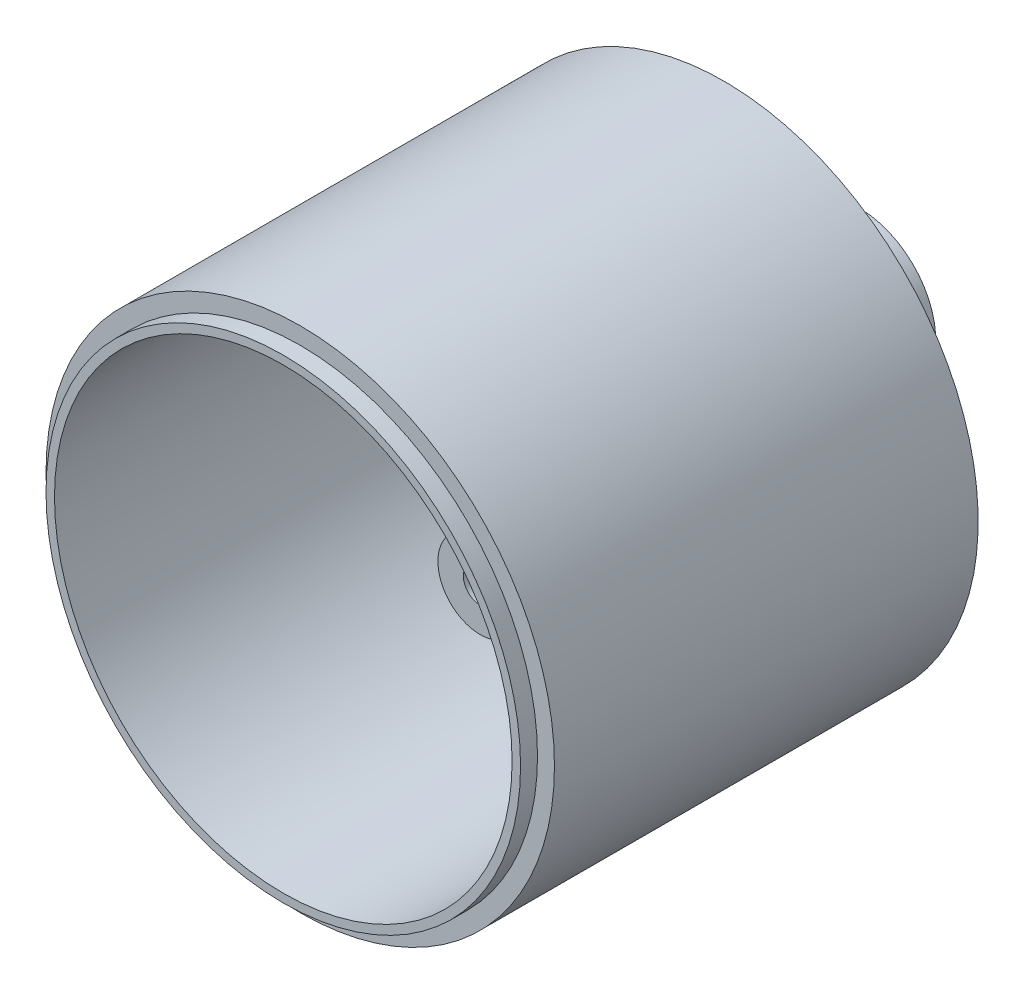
SolidWorks part; units mm, degrees
ref_plane "Face" through (0, 0, 0) normal (0, 0, 1) x (1, 0, 0)
ref_plane "Dessus" through (0, 0, 0) normal (0, 1, 0) x (1, 0, 0)
ref_plane "Droite" through (0, 0, 0) normal (1, 0, 0) x (0, 0, -1)
sketch "Esquisse1" plane through (0, 0, 0) normal (0, 0, 1) x (1, 0, 0)
  circle A0 centre (0, 0) radius 15
  dimension "D1" = 30
extrude "Centrage corps" add sketch "Esquisse1" along normal mid plane 5.5
sketch "Esquisse2" plane through (0, 0, -2.75) normal (0, 0, -1) x (-1, 0, 0)
  line L0 (0, 0) -> (0, -15) construction
  circle A2 centre (0, 0) radius 15
  circle A3 centre (0, 0) radius 15
  dimension "D2" = 0
extrude "Logement pignonerie" add sketch "Esquisse2" along normal blind 19.5
sketch "Esquisse3" plane through (0, 0, -22.25) normal (0, 0, -1) x (-1, 0, 0)
  circle A0 centre (0, 0) radius 5
  dimension "D1" = 10
extrude "Bossage" add sketch "Esquisse3" along normal blind 2
sketch "Esquisse4" plane through (0, 0, -24.25) normal (0, 0, -1) x (-1, 0, 0)
  circle A0 centre (0, 0) radius 4.5
  dimension "D1" = 9
extrude "Guidage de sortie" add sketch "Esquisse4" along normal blind 6
shell "Coque " thickness 1.5
sketch "Esquisse6" plane through (0, 0, -30.25) normal (0, 0, -1) x (-1, 0, 0)
  circle A0 centre (0, 0) radius 2
  dimension "D1" = 4
extrude "Sortie" cut sketch "Esquisse6" against normal through all
sketch "Esquisse8" plane through (0, 0, -20.75) normal (0, 0, 1) x (1, 0, 0)
  circle A0 centre (-3.375, -6.9765) radius 2.5
  dimension "D3" = 5
  dimension "D1" = 7.75
  dimension "D2" = 3.375
extrude "Bossage axe 1" add sketch "Esquisse8" along normal blind 9.5 thin
sketch "Esquisse11" plane through (0, 0, -20.75) normal (0, 0, 1) x (1, 0, 0)
  circle A0 centre (3.3692, -7.2559) radius 2.5
  dimension "D3" = 5
  dimension "D1" = 8
  dimension "D2" = 6.75
extrude "Bossage axe 2" add sketch "Esquisse11" along normal blind 3 thin
sketch "Esquisse9" plane through (0, 0, 2.75) normal (0, 0, 1) x (1, 0, 0)
  circle A0 centre (0, 0) radius 13.5 construction
  circle A1 centre (0, 0) radius 13.5
extrude "Liseré" add sketch "Esquisse9" along normal blind 1 thin
sketch "Esquisse12" plane through (0, 0, -20.75) normal (0, 0, 1) x (1, 0, 0)
  circle A0 centre (0, 0) radius 6
  dimension "D1" = 12
extrude "Passage pignon de sortie" cut sketch "Esquisse12" along normal through all
